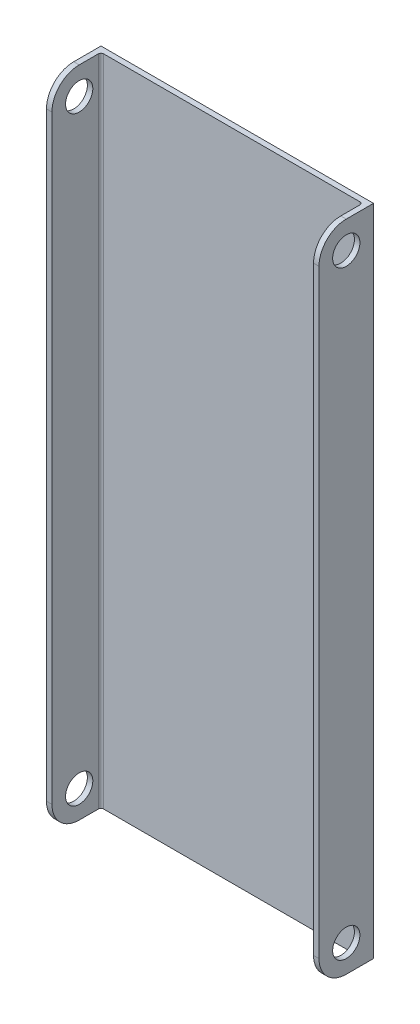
SolidWorks part; units mm, degrees
ref_plane "Front Plane" through (0, 0, 0) normal (0, 0, 1) x (1, 0, 0)
ref_plane "Top Plane" through (0, 0, 0) normal (0, 1, 0) x (1, 0, 0)
ref_plane "Right Plane" through (0, 0, 0) normal (1, 0, 0) x (0, 0, -1)
sketch "Sketch3" plane through (0, 0, 0) normal (0, 0, 1) x (1, 0, 0)
  line L1 (0, 0) -> (-63.5, 0)
  line L2 (0, 0) -> (0, 152.4)
  line L3 (0, 152.4) -> (-63.5, 152.4)
  line L4 (-63.5, 0) -> (-63.5, 152.4)
  dimension "D1" = 152.4
  dimension "D2" = 63.5
extrude "Boss-Extrude1" add sketch "Sketch3" along normal blind 1.27
sketch "Sketch4" plane through (0, 0, 0) normal (1, 0, 0) x (0, 0, -1)
  line L0 (-1.27, 152.4) -> (0, 152.4) construction
  line L1 (0, 0) -> (-12.7, 0)
  line L2 (0, 0) -> (0, 152.4)
  line L3 (0, 152.4) -> (-12.7, 152.4)
  line L4 (-12.7, 0) -> (-12.7, 152.4)
  circle A0 centre (-6.35, 6.35) radius 3.175
  circle A1 centre (-6.35, 146.05) radius 3.175
  point P11 (0, 0)
  dimension "D2" = 6.35
  dimension "D1" = 12.7
  dimension "D3" = 6.35
  dimension "D4" = 6.35
  dimension "D5" = 6.35
extrude "Boss-Extrude2" add sketch "Sketch4" against normal blind 1.27
ref_plane "Plane1" through (-31.75, 0, 0) normal (1, 0, 0) x (0, 0, -1)
mirror "Mirror3" about plane through (-31.75, 0, 0) normal (1, 0, 0) of "Boss-Extrude2"
fillet "Fillet1" radius 6.35 4 edges at (-62.865, 0, 12.7) (-62.865, 152.4, 12.7) (-0.635, 152.4, 12.7) (-0.635, 0, 12.7)
fillet "Fillet3" radius 0.635 2 edges at (-62.23, 76.2, 1.27) (-1.27, 76.2, 1.27)
equation "\"A\"= 20.50"
equation "\"B\"= 6.50"
equation "\"C\"= 36"
